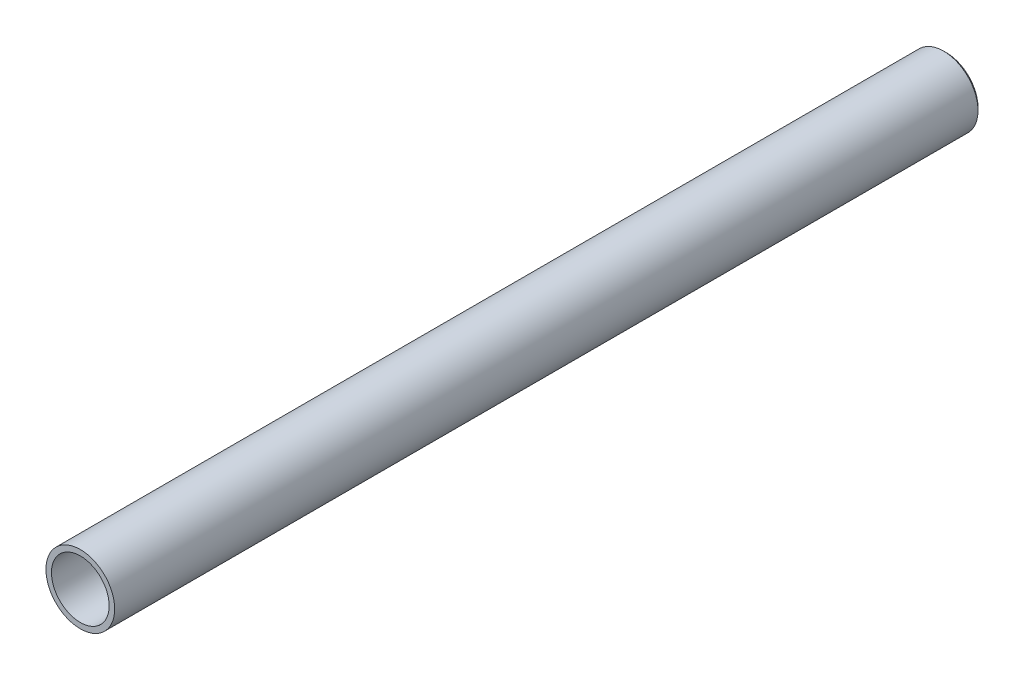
SolidWorks part; units mm, degrees
ref_plane "Plane1" through (0, 0, 0) normal (0, 0, 1) x (1, 0, 0)
ref_plane "Plane2" through (0, 0, 0) normal (0, 1, 0) x (1, 0, 0)
ref_plane "Plane3" through (0, 0, 0) normal (1, 0, 0) x (0, 0, -1)
sketch "Esquisse1" plane through (0, 0, 0) normal (0, 0, 1) x (1, 0, 0)
  circle A0 centre (0, 0) radius 12.5
  dimension "D1" = 25
extrude "Base-Extrusion" add sketch "Esquisse1" along normal blind 315
sketch "Esquisse2" plane through (0, 0, 315) normal (0, 0, 1) x (1, 0, 0)
  circle A0 centre (0, 0) radius 10.5
  dimension "D1" = 21
extrude "Enlèv. mat.-Extru.1" cut sketch "Esquisse2" against normal blind 415
chamfer "Chanfrein2" distance 1 angle 45
chamfer "Chanfrein3" distance 1 angle 45
